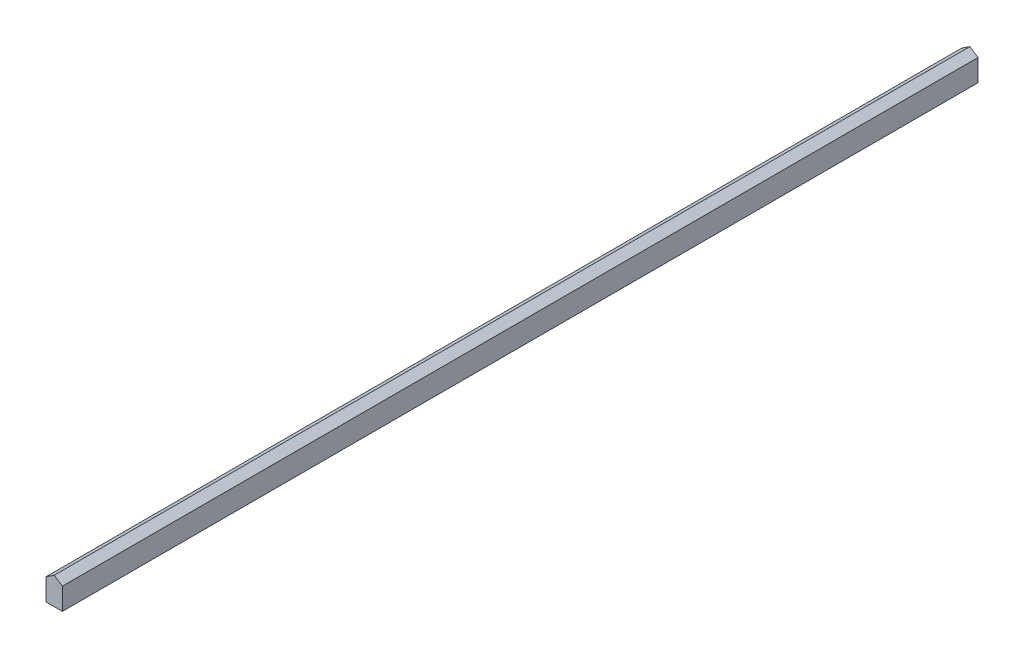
SolidWorks part; units mm, degrees
ref_plane "Face" through (0, 0, 0) normal (0, 0, 1) x (1, 0, 0)
ref_plane "Dessus" through (0, 0, 0) normal (0, 1, 0) x (1, 0, 0)
ref_plane "Droite" through (0, 0, 0) normal (1, 0, 0) x (0, 0, -1)
sketch "Esquisse1" plane through (0, 0, 0) normal (0, 0, 1) x (1, 0, 0)
  line L1 (0, 0) -> (15, 0)
  line L2 (0, 0) -> (0, 25)
  line L3 (0, 25) -> (15, 25)
  line L4 (15, 0) -> (15, 25)
  dimension "D1" = 15
  dimension "D2" = 25
extrude "Extrusion1" add sketch "Esquisse1" along normal blind 840
sketch "Esquisse2" plane through (0, 0, 840) normal (0, 0, 1) x (1, 0, 0)
  line L0 (7.5, 25) -> (0, 20.0385)
  line L1 (0, 20.0385) -> (0, 31.4234)
  line L2 (15, 31.4234) -> (0, 31.4234)
  line L3 (15, 25) -> (0, 25) construction
  line L4 (7.5, 25) -> (7.5, 21.253) construction
  line L5 (15, 20.0385) -> (15, 31.4234)
  line L6 (7.5, 25) -> (15, 20.0385)
  line L7 (0, 25) -> (0, 0) construction
  line L8 (0, 0) -> (15, 0) construction
  dimension "D1" = 7.5
  dimension "D2" = 33.486
extrude "Enlèv. mat.-Extru.2" cut sketch "Esquisse2" against normal through all
